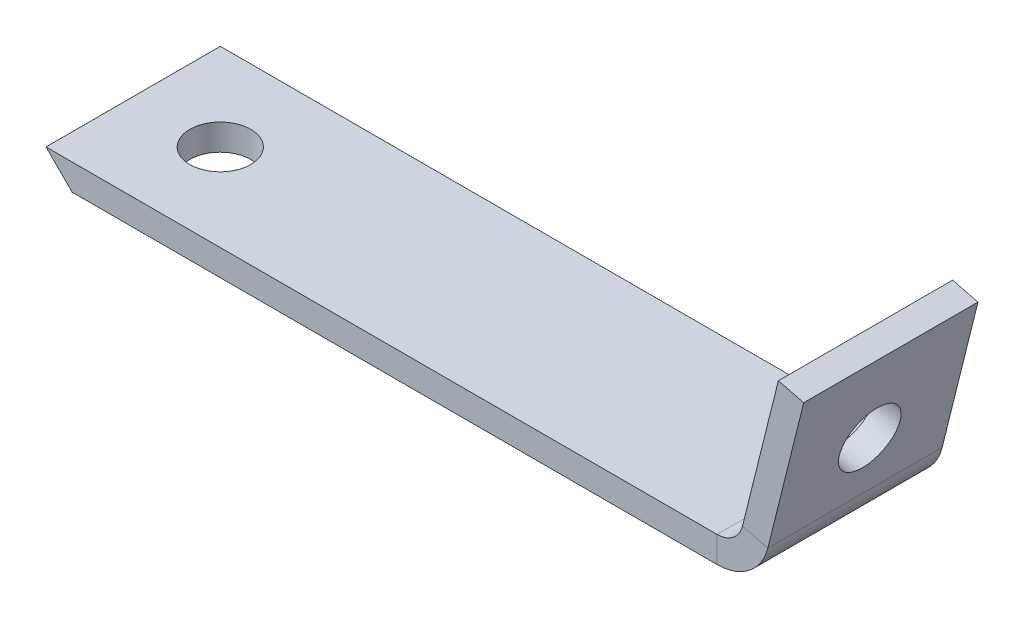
SolidWorks part; units mm, degrees
ref_plane "Front" through (0, 0, 0) normal (0, 0, 1) x (1, 0, 0)
ref_plane "Top" through (0, 0, 0) normal (0, 1, 0) x (1, 0, 0)
ref_plane "Right" through (0, 0, 0) normal (1, 0, 0) x (0, 0, -1)
sketch "Sketch1" plane through (0, 0, 0) normal (0, 1, 0) x (1, 0, 0)
  line L1 (0, 0) -> (50, 0)
  line L2 (0, 0) -> (0, 10)
  line L3 (0, 10) -> (50, 10)
  line L4 (50, 0) -> (50, 10)
  circle A0 centre (5, 5) radius 1.75
  circle A1 centre (45, 5) radius 1.75
  dimension "D1" = 5
  dimension "D2" = 5
  dimension "D3" = 40
sheet metal parameters "Sheet-Metal1" thickness 1.5 parameters "D1"=1.5
base flange "Base-Flange1" sketch "Sketch1" thickness 1.5 reverse thickness direction yes parameters "D1"=1.5
sketch "Sketch3" plane through (0, 1.5, 0) normal (0, 1, 0) x (-1, 0, 0)
  line L0 (-50, 0) -> (-50, -10) construction
  line L1 (-40, 0) -> (-40, -10)
  point P0 (-50, -5)
  dimension "D1" = 10
sketched bend "Sketched Bend1" parameters "D1"=1.5
bend "SketchBend1" bend radius 1.5 bend angle 76 parameters "D5"=1
chamfer "Chamfer1" distance 1.5 angle 45 1 edges at (0, 0, -5)
flat pattern "Flat-Pattern1"
sketch "Bend-Lines1" plane through (0, 0, 0) normal (0, 1, 0) x (-1, 0, 0)
bend of the flat pattern "Flatten-<SketchBend1>1"
